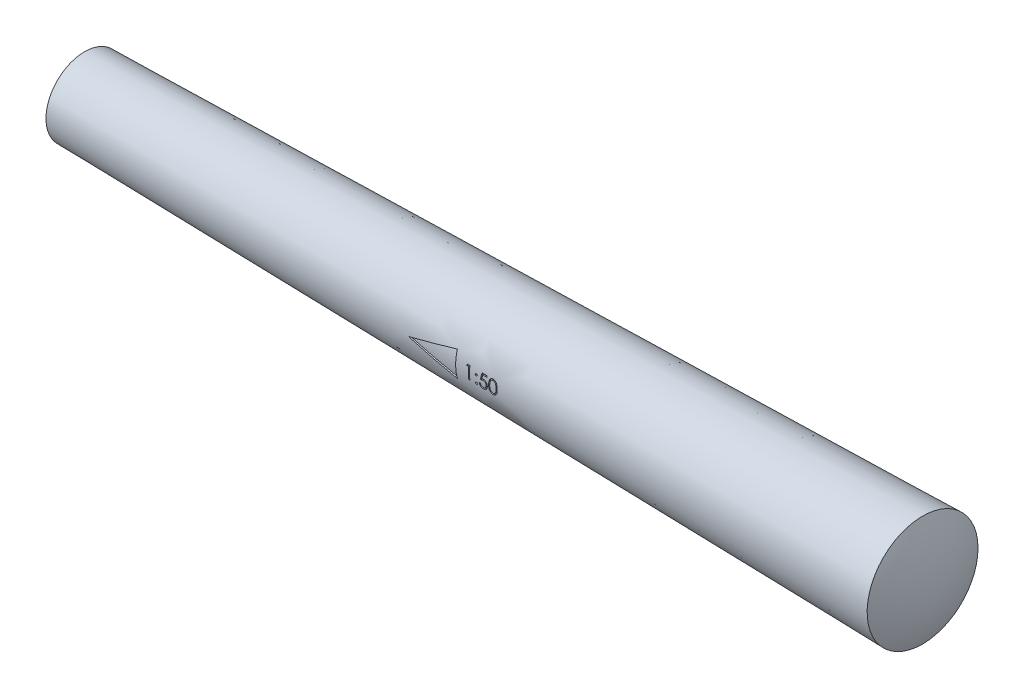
SolidWorks part; units mm, degrees
ref_plane "Front Plane" through (0, 0, 0) normal (0, 0, 1) x (1, 0, 0)
ref_plane "Top Plane" through (0, 0, 0) normal (0, 1, 0) x (1, 0, 0)
ref_plane "Right Plane" through (0, 0, 0) normal (1, 0, 0) x (0, 0, -1)
sketch "Sketch1" plane through (0, 0, 0) normal (1, 0, 0) x (0, 0, -1)
  circle A0 centre (0, 0) radius 3
  dimension "D1" = 6
extrude "Extrude1" add sketch "Sketch1" along normal mid plane 65
draft "Draft1" type of draft neutral plane draft angle 1.146 faces to draft 1 parameters "D1"=1.146
sketch "Sketch2" plane through (0, 0, 0) normal (0, 0, 1) x (1, 0, 0)
  line L0 (-32.5, 0) -> (-32.5, 3)
  line L1 (-32.5, 3) -> (-32.5, -3) construction
  line L2 (-32.5, 0) -> (-33.4, 0)
  line L3 (-33.4, 0) -> (-33.4, -3.65) construction
  line L4 (32.5, 0) -> (32.5, 4.3)
  line L5 (32.5, -4.3) -> (32.5, 4.3) construction
  line L6 (32.5, 0) -> (33.4, 0)
  line L7 (33.4, 0) -> (33.4, -3.65) construction
  line L8 (-32.5, -3) -> (32.5, -4.3) construction
  arc A0 (-33.4, 0) -> (-32.5, 3) centre (-27.95, 0) cw
  arc A1 (33.4, 0) -> (32.5, 4.3) centre (22.6776, 0) ccw
  point P14 (0, -3.65)
revolve "Revolve1" add sketch "Sketch2" angle 360 about L2
sketch "Sketch5" plane through (0, 0, 0) normal (0, 0, 1) x (1, 0, 0)
  line L0 (0, 3.65) -> (0, -3.65) construction
  line L1 (32.5, 4.3) -> (-32.5, 3) construction
  line L2 (-32.5, -3) -> (32.5, -4.3) construction
ref_plane "Plane2" through (0, 0, 0) normal (-0.02, 0, 0.9998) x (0.9998, 0, 0.02)
sketch "Sketch6" plane through (0, 0, 0) normal (-0.02, 0, 0.9998) x (0.9998, 0, 0.02)
  line L0 (0, 0) -> (0, 1)
  line L1 (0, 3.65) -> (0, -3.65) construction
  line L2 (0, 1) -> (-3.7321, 0)
  line L3 (-3.7321, 0) -> (0, -1)
  line L4 (0, -1) -> (0, 0)
  line L5 (0, -0.5) -> (4, -0.5) construction
  text T0 "1:50" font "Century Gothic" height 1
  dimension "D1" = 2
  dimension "D2" = 30
  dimension "D3" = 4
wrap "Wrap2" sketch "Sketch6" wrap type deboss source sketch "Sketch6" thickness 0.1 parameters "D1"=0.1
equation "\"D2@Sketch2\" = \"D1@Sketch2\""
